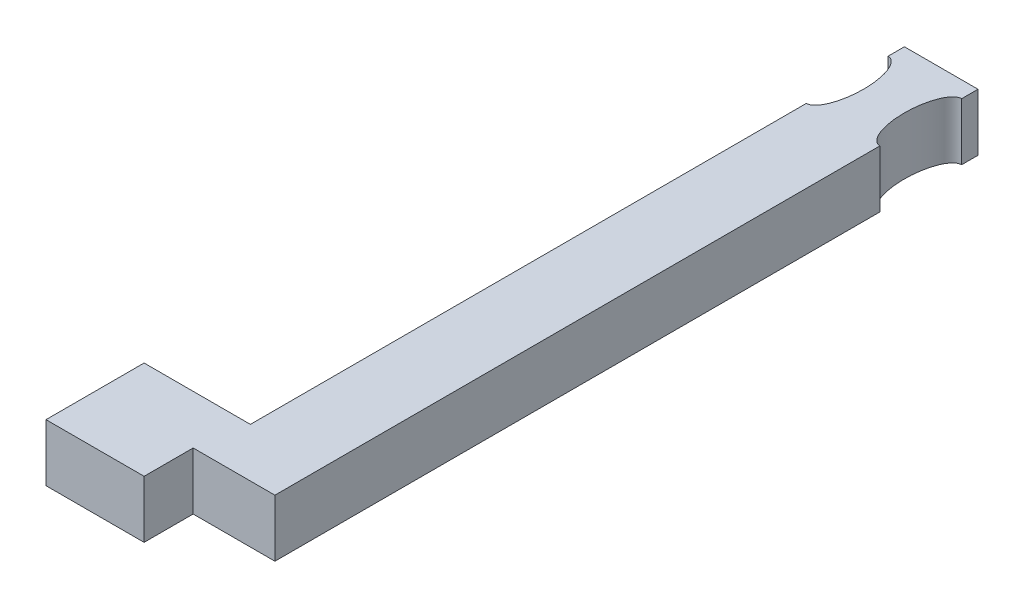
SolidWorks part; units mm, degrees
ref_plane "Plan de face" through (0, 0, 0) normal (0, 0, 1) x (1, 0, 0)
ref_plane "Plan de dessus" through (0, 0, 0) normal (0, 1, 0) x (1, 0, 0)
ref_plane "Plan de droite" through (0, 0, 0) normal (1, 0, 0) x (0, 0, -1)
sketch "Esquisse1" plane through (0, 0, 0) normal (0, 1, 0) x (1, 0, 0)
  line L0 (-3.3452, 0) -> (28.6459, 0) construction
  line L1 (0, -3.2572) -> (0, 12.6712) construction
  line L2 (6, -3.2572) -> (6, 11.0064) construction
  line L3 (-3.3452, 6) -> (17.1156, 6) construction
  line L4 (6.5, 53.9166) -> (6.5, 7.6443) construction
  line L5 (11, 53.9166) -> (11, 3.8746) construction
  line L6 (19.9859, 3) -> (2.8696, 3) construction
  line L7 (28.6459, 46) -> (2.8696, 46) construction
  line L8 (3, 12.6712) -> (3, 2.9746) construction
  line L9 (4.5, 16.1985) -> (4.5, 2.625) construction
  line L10 (6, 3) -> (11, 3)
  line L11 (6.5, 46) -> (11, 46)
  line L12 (6.5, 46) -> (6.5, 45)
  line L13 (2.8696, 45) -> (14.8728, 45) construction
  line L14 (11, 46) -> (11, 45)
  line L15 (0, 0) -> (6, 0)
  line L16 (0, 0) -> (0, 6)
  line L17 (0, 6) -> (6.5, 6)
  line L18 (6, 0) -> (6, 3)
  line L19 (2.8696, 40) -> (14.8728, 40) construction
  line L20 (10, 49.2536) -> (10, 38.7134) construction
  line L22 (12.0803, 42.5) -> (9.4985, 42.5) construction
  line L23 (11, 40) -> (11, 3)
  line L24 (6.5, 40) -> (6.5, 6)
  ellipse E0 centre (11, 42.5) end of major axis (11, 45) minor radius 1 (11, 45) -> (11, 40) ccw
  ellipse E1 centre (6.5, 42.5) end of major axis (6.5, 45) minor radius 1 (6.5, 45) -> (6.5, 40) cw
  dimension "D1" = 6
  dimension "D2" = 3
  dimension "D3" = 6
  dimension "D4" = 4.5
  dimension "D5" = 3
  dimension "D6" = 1.5
  dimension "D7" = 2
  dimension "D8" = 40
  dimension "D9" = 1
  dimension "D10" = 5
  dimension "D11" = 2.5
  dimension "D12" = 1
extrude "Boss.-Extru.1" add sketch "Esquisse1" along normal blind 3.5
sketch "Esquisse2" plane through (0, 0, 0) normal (0, -1, 0) x (1, 0, 0)
  line L0 (3, 0) -> (3, -7.5555) construction
  line L1 (8.6244, -3) -> (-0.4666, -3) construction
  line L2 (8.6244, 0) -> (-0.7088, 0) construction
  line L3 (0, 0) -> (6, 0) construction
  line L5 (1.3, -1.3) -> (4.7, -1.3)
  line L6 (1.3, -1.3) -> (1.3, -4.7)
  line L7 (1.3, -4.7) -> (4.7, -4.7)
  line L8 (4.7, -1.3) -> (4.7, -4.7)
  line L9 (1.3, -1.3) -> (4.7, -4.7) construction
  line L10 (1.3, -4.7) -> (4.7, -1.3) construction
  point P8 (3, -3)
  dimension "D1" = 3
extrude "Enlèv. mat.-Extru.1" cut sketch "Esquisse2" against normal blind 2.5
